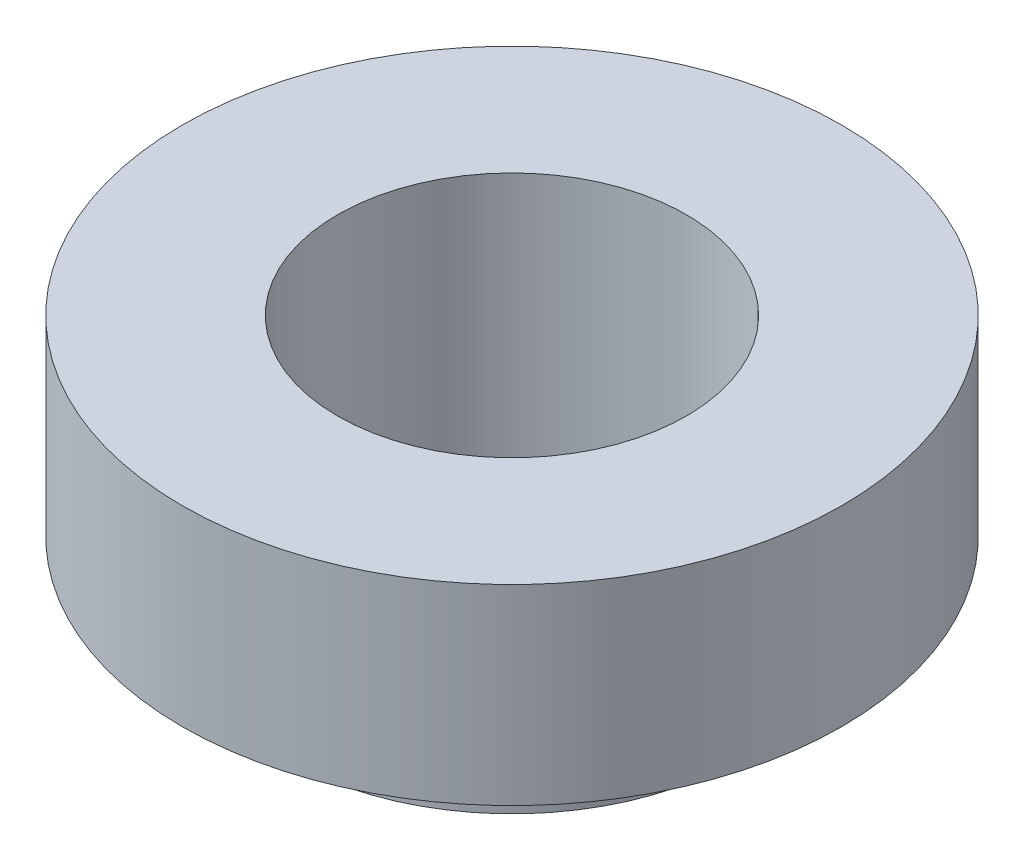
SolidWorks part; units mm, degrees
ref_plane "Plane1" through (0, 0, 0) normal (0, 0, 1) x (1, 0, 0)
ref_plane "Plane2" through (0, 0, 0) normal (0, 1, 0) x (1, 0, 0)
ref_plane "Plane3" through (0, 0, 0) normal (1, 0, 0) x (0, 0, -1)
sketch "Sketch1" plane through (0, 0, 0) normal (0, 1, 0) x (1, 0, 0)
  circle A0 centre (0, 0) radius 2.6924
  dimension "D1" = 5.3848
extrude "Base-Extrude" add sketch "Sketch1" along normal blind 0.9652
sketch "Sketch2" plane through (0, 0.9652, 0) normal (0, 1, 0) x (-1, 0, 0)
  circle A0 centre (0, 0) radius 3.937
  dimension "D1" = 7.874
extrude "Boss-Extrude1" add sketch "Sketch2" along normal blind 2.286
sketch "Sketch3" plane through (0, 3.2512, 0) normal (0, 1, 0) x (-1, 0, 0)
  circle A0 centre (0, 0) radius 2.0828
  dimension "D1" = 4.1656
extrude "Cut-Extrude1" cut sketch "Sketch3" against normal through all
